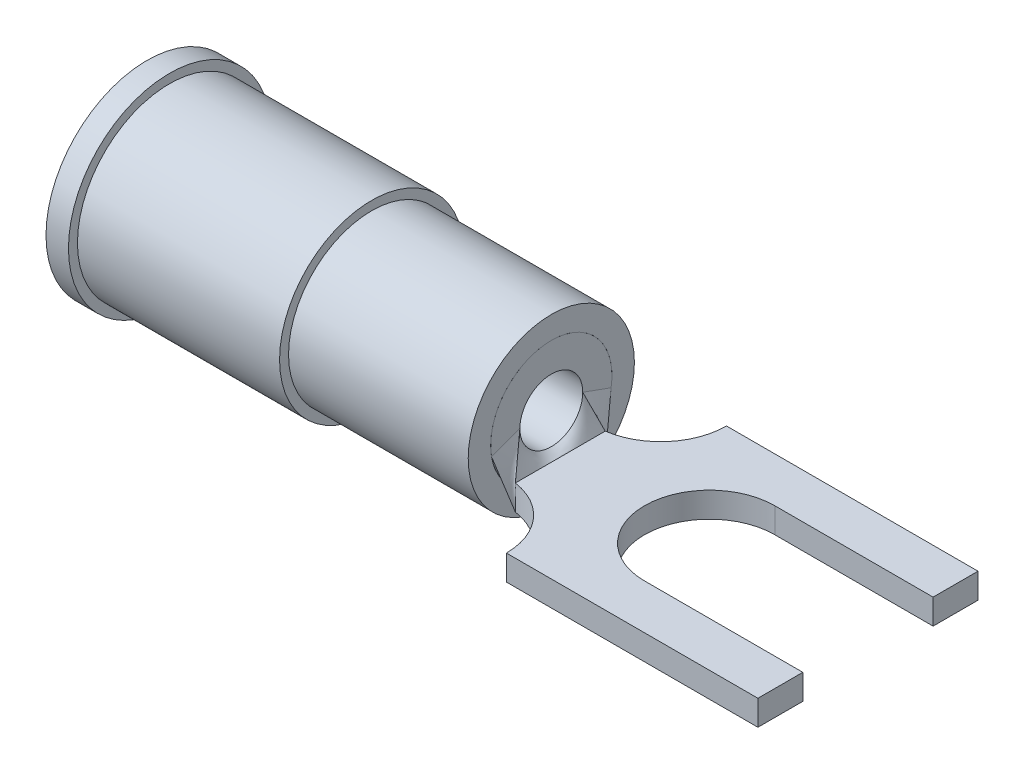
SolidWorks part; units mm, degrees
ref_plane "Front Plane" through (0, 0, 0) normal (0, 0, 1) x (1, 0, 0)
ref_plane "Top Plane" through (0, 0, 0) normal (0, 1, 0) x (1, 0, 0)
ref_plane "Right Plane" through (0, 0, 0) normal (1, 0, 0) x (0, 0, -1)
sketch "Sketch5" plane through (0, 0, 0) normal (0, 0, 1) x (1, 0, 0)
  line L0 (0, 0) -> (11.43, 0) construction
  line L1 (0, 0) -> (0, 2.8575) construction
  line L2 (0, 2.8575) -> (0.635, 2.8575)
  line L3 (0, 2.8575) -> (0, 1.8923)
  line L4 (0, 1.8923) -> (0.635, 1.8923)
  line L5 (6.35, 0) -> (6.35, 0.7937) construction
  line L6 (0.635, 1.8923) -> (6.35, 0.7937)
  line L7 (0.635, 2.8575) -> (0.635, 2.6035)
  line L8 (0.635, 2.6035) -> (6.35, 2.6035)
  line L9 (6.35, 2.6035) -> (6.35, 2.3495)
  line L10 (6.35, 2.3495) -> (11.43, 2.3495)
  line L11 (11.43, 2.3495) -> (11.43, 1.7145)
  line L12 (6.35, 0.7937) -> (6.35, 1.7145)
  line L13 (6.35, 1.7145) -> (11.43, 1.7145)
  dimension "D1" = 11.43
  dimension "D2" = 2.8575
  dimension "D3" = 0.635
  dimension "D4" = 0.9652
  dimension "D5" = 0.7937
  dimension "D6" = 6.35
  dimension "D7" = 0.254
  dimension "D8" = 0.254
  dimension "D9" = 1.7145
revolve "Revolve1" add sketch "Sketch5" angle 360 about L0
ref_plane "Plane1" through (0, -1.016, 0) normal (0, 1, 0) x (-1, 0, 0)
sketch "Sketch7" plane through (0, -1.016, 0) normal (0, 1, 0) x (-1, 0, 0)
  line L0 (-11.43, -1.8415) -> (-20.3835, -1.8415) construction
  line L2 (-11.43, 0) -> (-20.7986, 0) construction
  line L3 (-11.43, 2.3495) -> (-11.43, -2.3495) construction
  line L4 (-11.43, 2.3495) -> (-11.43, -2.3495) construction
  line L8 (-11.43, -3.1115) -> (-20.7986, -3.1115) construction
  line L10 (-13.2715, -3.1115) -> (-20.3835, -3.1115)
  line L12 (-20.3835, -3.1115) -> (-20.3835, -1.8415)
  line L13 (-20.3835, -1.8415) -> (-15.9067, -1.8415)
  line L15 (-20.3835, 1.8415) -> (-15.9067, 1.8415)
  line L16 (-20.3835, 3.1115) -> (-20.3835, 1.8415)
  line L17 (-13.2715, 3.1115) -> (-20.3835, 3.1115)
  line L18 (-11.684, -1.27) -> (-11.684, 1.27)
  arc A0 (-13.2715, -3.1115) -> (-11.684, -1.27) centre (-11.4097, -3.1115) cw
  arc A1 (-13.2715, 3.1115) -> (-11.684, 1.27) centre (-11.4097, 3.1115) ccw
  arc A2 (-15.9067, -1.8415) -> (-15.9067, 1.8415) centre (-15.9067, 0) ccw
  dimension "D2" = 1.5875
  dimension "D1" = 2.54
  dimension "D3" = 7.112
  dimension "D4" = 3.1115
  dimension "D7" = 1.8415
extrude "Extrude6" add sketch "Sketch7" against normal blind 0.7112 separate body
sketch "Sketch11" plane through (11.43, 0, 0) normal (1, 0, 0) x (0, 0, -1)
  circle A0 centre (0, 0) radius 0.889
  circle A1 centre (0, 0) radius 1.7145
  dimension "D1" = 1.778
extrude "Extrude7" add sketch "Sketch11" against normal offset from surface (5.08 mm away) 6.35 separate body
sketch "Sketch12" plane through (11.43, 0, 0) normal (1, 0, 0) x (0, 0, -1)
  line L0 (0, 0) -> (-0.889, 0) construction
  line L1 (-0.889, 0) -> (-1.6896, -0.2914)
  line L2 (0, 0) -> (0, 0.4672) construction
  line L3 (0.889, 0) -> (1.6896, -0.2914)
  circle A0 centre (0, 0) radius 0.889 construction
  circle A1 centre (0, 0) radius 1.7145 construction
  arc A2 (-0.889, 0) -> (0.889, 0) centre (0, 0) ccw
  arc A3 (-1.6896, -0.2914) -> (1.6896, -0.2914) centre (0, 0) ccw
  dimension "D1" = 20
loft "Loft3" add
